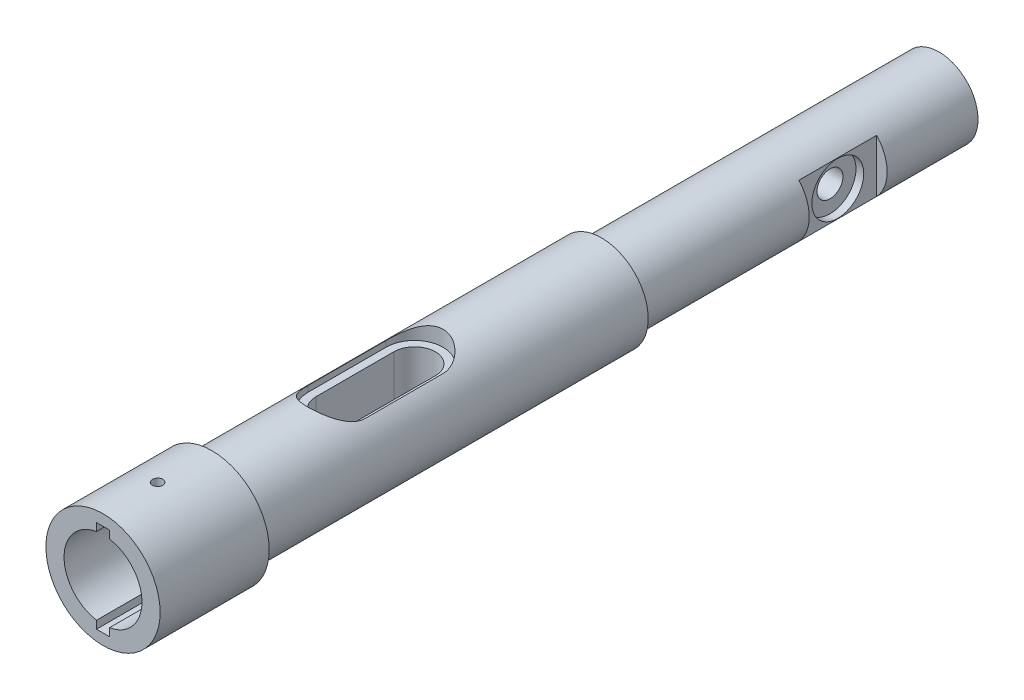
SolidWorks part; units mm, degrees
ref_plane "Front" through (0, 0, 0) normal (0, 0, 1) x (1, 0, 0)
ref_plane "Top" through (0, 0, 0) normal (0, 1, 0) x (1, 0, 0)
ref_plane "Right" through (0, 0, 0) normal (1, 0, 0) x (0, 0, -1)
sketch "Sketch1" plane through (0, 0, 0) normal (0, 0, 1) x (1, 0, 0)
  circle A0 centre (0, 0) radius 11
  dimension "D1" = 22
extrude "Base-Extrude" add sketch "Sketch1" against normal blind 96
sketch "Sketch2" plane through (0, 0, -96) normal (0, 0, -1) x (-1, 0, 0)
  circle A0 centre (0, 0) radius 7.5
  dimension "D1" = 15
extrude "Boss-Extrude1" add sketch "Sketch2" along normal blind 65
sketch "Sketch9" plane through (0, 0, 0) normal (0, 1, 0) x (1, 0, 0)
  line L0 (-4, 60) -> (-4, 45)
  line L1 (4, 45) -> (4, 60)
  line L2 (0, 0) -> (0, 60) construction
  arc A0 (-4, 45) -> (4, 45) centre (0, 45) ccw
  arc A1 (4, 60) -> (-4, 60) centre (0, 60) ccw
  dimension "D1" = 15
  dimension "D3" = 4
  dimension "D2" = 45
extrude "Cut-Extrude3" cut sketch "Sketch9" against normal through all and the other way through all
sketch "Sketch10" plane through (0, 0, -96) normal (0, 0, -1) x (-1, 0, 0)
  circle A0 centre (0, 0) radius 9
  dimension "D1" = 18
extrude "Cut-Extrude4" cut sketch "Sketch10" against normal blind 75 flip side to cut
sketch "Sketch11" plane through (0, 0, 0) normal (0, 0, 1) x (0, -1, 0)
  line L0 (0, 0) -> (0, 7.5) construction
  line L2 (7.3951, 1.25) -> (8.8951, 1.25)
  line L3 (8.8951, 1.25) -> (8.8951, -1.25)
  line L4 (8.8951, -1.25) -> (7.3951, -1.25)
  line L5 (0, 0) -> (8.8951, 0) construction
  line L6 (-8.8951, -1.25) -> (-7.3951, -1.25)
  line L7 (-8.8951, 1.25) -> (-8.8951, -1.25)
  line L8 (-7.3951, 1.25) -> (-8.8951, 1.25)
  arc A0 (-7.3951, -1.25) -> (7.3951, -1.25) centre (0, 0) ccw
  arc A3 (7.3951, 1.25) -> (-7.3951, 1.25) centre (0, 0) ccw
  dimension "D1" = 15
  dimension "D2" = 1.5
  dimension "D3" = 2.5
ref_plane "Plane1" through (0, 9, -58.5) normal (0, 1, 0) x (1, 0, 0)
sketch "Sketch16" plane through (0, 9, -58.5) normal (0, 1, 0) x (1, 0, 0)
  line L4 (5.5, -13.5) -> (5.5, 1.5)
  line L5 (-5.5, 1.5) -> (-5.5, -13.5)
  line L6 (5.5, -13.5) -> (5.5, 1.5)
  line L7 (-5.5, 1.5) -> (-5.5, -13.5)
  arc A4 (5.5, 1.5) -> (-5.5, 1.5) centre (0, 1.5) ccw
  arc A5 (-5.5, -13.5) -> (5.5, -13.5) centre (0, -13.5) ccw
  arc A6 (5.5, 1.5) -> (-5.5, 1.5) centre (0, 1.5) ccw
  arc A7 (-5.5, -13.5) -> (5.5, -13.5) centre (0, -13.5) ccw
  dimension "D1" = 1.5
extrude "Cut-Extrude8" cut sketch "Sketch16" against normal blind 3
mirror "Mirror2" about plane through (0, 0, 0) normal (0, 1, 0) of "Cut-Extrude8"
sketch "Sketch23" plane through (0, 0, 0) normal (0, 1, 0) x (1, 0, 0)
  line L0 (-7.5, 161) -> (-7.5, 96) construction
  line L3 (-7.5, 136) -> (-7.5, 141)
  line L5 (-7.5, 141) -> (-4, 141)
  line L6 (-4, 141) -> (-4, 138.5)
  line L7 (-4, 138.5) -> (4, 138.5)
  line L8 (4, 138.5) -> (4, 141)
  line L9 (4, 141) -> (7.5, 141)
  line L11 (7.5, 141) -> (7.5, 136)
  line L12 (7.5, 136) -> (-7.5, 136)
  line L14 (7.5, 161) -> (-7.5, 161) construction
  line L15 (7.5, 96) -> (7.5, 161) construction
  dimension "D1" = 5
  dimension "D2" = 2.5
  dimension "D3" = 3.5
  dimension "D4" = 25
revolve "Cut-Revolve2" cut sketch "Sketch23" angle 360 about L12
ref_plane "Plane2" through (7.5, 0, -128.5) normal (1, 0, 0) x (0, 1, 0)
sketch "Sketch24" plane through (7.5, 0, -128.5) normal (1, 0, 0) x (0, 1, 0)
  line L0 (7.5, -32.5) -> (7.5, 32.5) construction
  line L1 (-7.5, 0) -> (7.5, 0)
  line L2 (-7.5, 0) -> (-7.5, -15)
  line L3 (-7.5, -15) -> (7.5, -15)
  line L4 (7.5, 0) -> (7.5, -15)
  line L5 (-7.5, 32.5) -> (-7.5, -32.5) construction
  line L6 (-7.5, -15) -> (7.5, 0) construction
  point P8 (0, -7.5)
  dimension "D1" = 15
extrude "Cut-Extrude13" cut sketch "Sketch24" against normal blind 2
mirror "Mirror3" about plane through (0, 0, 0) normal (1, 0, 0) of "Cut-Extrude13"
extrude "Cut-Extrude15" cut sketch "Sketch11" against normal blind 18
ref_plane "Plane3" through (0, 11, -10.5) normal (0, 1, 0) x (-1, 0, 0)
sketch "Sketch25" plane through (0, 11, -10.5) normal (0, 1, 0) x (1, 0, 0)
  line L0 (0, 10.5) -> (0, -10.5) construction
  line L1 (11, 10.5) -> (-11, 10.5) construction
  line L5 (-11, -10.5) -> (11, -10.5) construction
  circle A0 centre (0, 0) radius 1
  dimension "D1" = 2
  dimension "D2" = 10.5
extrude "Cut-Extrude16" cut sketch "Sketch25" against normal blind 28 draft 1
